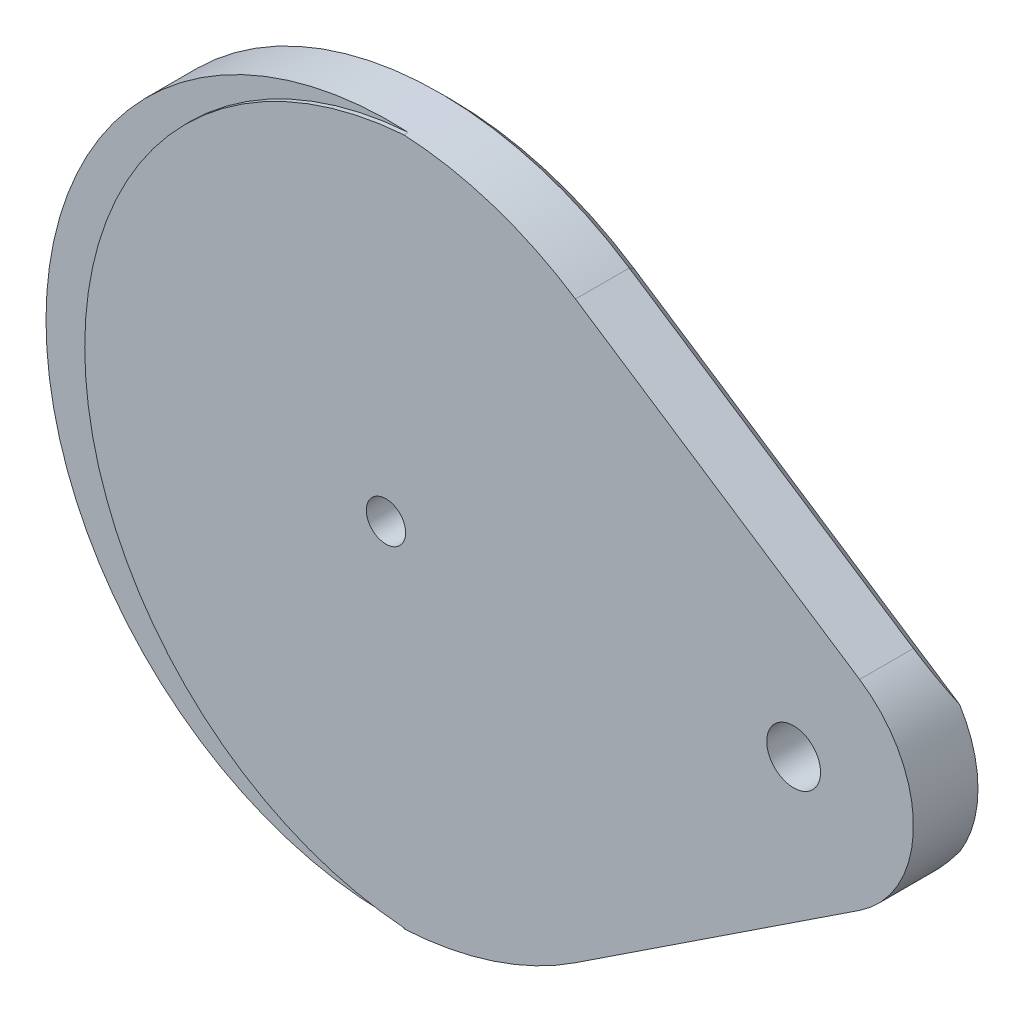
SolidWorks part; units mm, degrees
ref_plane "Plane1" through (0, 0, 0) normal (0, 0, 1) x (1, 0, 0)
ref_plane "Plane2" through (0, 0, 0) normal (0, 1, 0) x (1, 0, 0)
ref_plane "Plane3" through (0, 0, 0) normal (1, 0, 0) x (0, 0, -1)
sketch "Sketch1" plane through (0, 0, 0) normal (0, 0, 1) x (1, 0, 0)
  line L0 (0, 0) -> (120.3198, 0) construction
  line L1 (55.9368, 84.8153) -> (139.7858, 29.5157)
  line L2 (55.9368, -84.8153) -> (139.7858, -29.5157)
  arc A0 (55.9368, 84.8153) -> (55.9368, -84.8153) centre (0, 0) ccw
  arc A1 (139.7858, -29.5157) -> (139.7858, 29.5157) centre (120.3198, 0) ccw
  circle A2 centre (0, 0) radius 5.799
  circle A3 centre (120.3198, 0) radius 7.9375
  dimension "D1" = 203.2
  dimension "D3" = 70.7136
  dimension "D4" = 15.875
  dimension "D2" = 120.3198
extrude "Base-Extrude" add sketch "Sketch1" along normal blind 19.05
sketch "Sketch7" plane through (0, 0, 0) normal (0, 0, -1) x (-1, 0, 0)
  line L1 (-120.3198, -22.225) -> (-120.3198, -29.5157) construction
  line L3 (-123.4948, -19.05) -> (-123.4948, -7.2748)
  line L4 (-123.4948, 19.05) -> (-123.4948, 7.2748)
  line L8 (-123.4948, 7.2748) -> (-123.4948, -7.2748)
  line L9 (-120.3198, 19.05) -> (-120.3198, -22.225)
  line L10 (-120.3198, 19.05) -> (-120.3198, 22.225)
  arc A1 (-120.3198, 22.225) -> (-123.4948, 19.05) centre (-120.3198, 19.05) ccw
  arc A2 (-123.4948, -19.05) -> (-120.3198, -22.225) centre (-120.3198, -19.05) ccw
sketch "Sketch9" plane through (0, 0, 19.05) normal (0, 0, 1) x (1, 0, 0)
  line L0 (0, 0) -> (-128.5975, 0) construction
  line L1 (-101.6, 87.479) -> (-101.6, -104.4189) construction
  line L4 (0, 0) -> (39.2139, 0) construction
  line L5 (5.2733, 101.4606) -> (5.2733, 108.9186)
  line L6 (5.2733, -101.4606) -> (5.2733, -108.9186)
  line L7 (5.2595, -101.1949) -> (5.2733, -101.4606)
  arc A0 (55.9368, 84.8153) -> (55.9368, -84.8153) centre (0, 0) ccw construction
  arc A1 (5.2733, 101.4606) -> (5.2595, -101.1949) centre (12.7, 0.1323) ccw
  arc A2 (5.2733, 108.9186) -> (5.2733, -108.9186) centre (0, 0) ccw
extrude "Cut-Extrude2" cut sketch "Sketch9" against normal blind 1.27
sketch "Sketch11" plane through (0, 0, 0) normal (0, 0, -1) x (-1, 0, 0)
  line L0 (-54.1888, 82.1648) -> (-138.0378, 26.8652)
  line L1 (-138.0378, -26.8652) -> (-54.1888, -82.1648)
  line L2 (-55.9368, -84.8153) -> (-139.7858, -29.5157) construction
  line L3 (-55.9368, 84.8153) -> (-139.7858, 29.5157) construction
  line L5 (-138.0378, 26.8652) -> (-165.3558, 8.8486)
  line L6 (-138.0378, -26.8652) -> (-165.3558, -8.8486)
  line L8 (-165.3558, 8.8486) -> (-180.4454, -1.1032)
  arc A1 (-54.1888, -82.1648) -> (-54.1888, 82.1648) centre (0, 0) ccw
  dimension "D1" = 3.175
  dimension "D2" = 3.175
ref_plane "Plane11" through (139.7858, 29.5157, 0) normal (-0.8348, 0.5506, 0) x (0, 0, 1)
ref_plane "Plane12" through (126.2566, -83.268, 0) normal (-0.8348, 0.5506, 0) x (0, 0, 1)
sketch "Sketch15" plane through (126.2566, -83.268, 0) normal (-0.8348, 0.5506, 0) x (0, 0, 1)
  line L0 (-1.9162, 98.425) -> (0, 98.425)
  line L1 (3.175, 102.5804) -> (3.175, 101.6)
  line L2 (0, 101.6) -> (0, -101.6) construction
  line L3 (19.05, 101.6) -> (0, 101.6) construction
  line L4 (3.175, 101.6) -> (0, 98.425)
  line L5 (-1.9162, 98.425) -> (-1.9162, 102.5804)
  line L6 (-1.9162, 102.5804) -> (3.175, 102.5804)
  dimension "D1" = 3.175
  dimension "D2" = 3.175
sweep "Cut-Sweep4" cut profiles "Sketch15" path "Sketch11"
revolve "Cut-Revolve3" cut sketch "Sketch7" angle 360 about L1
